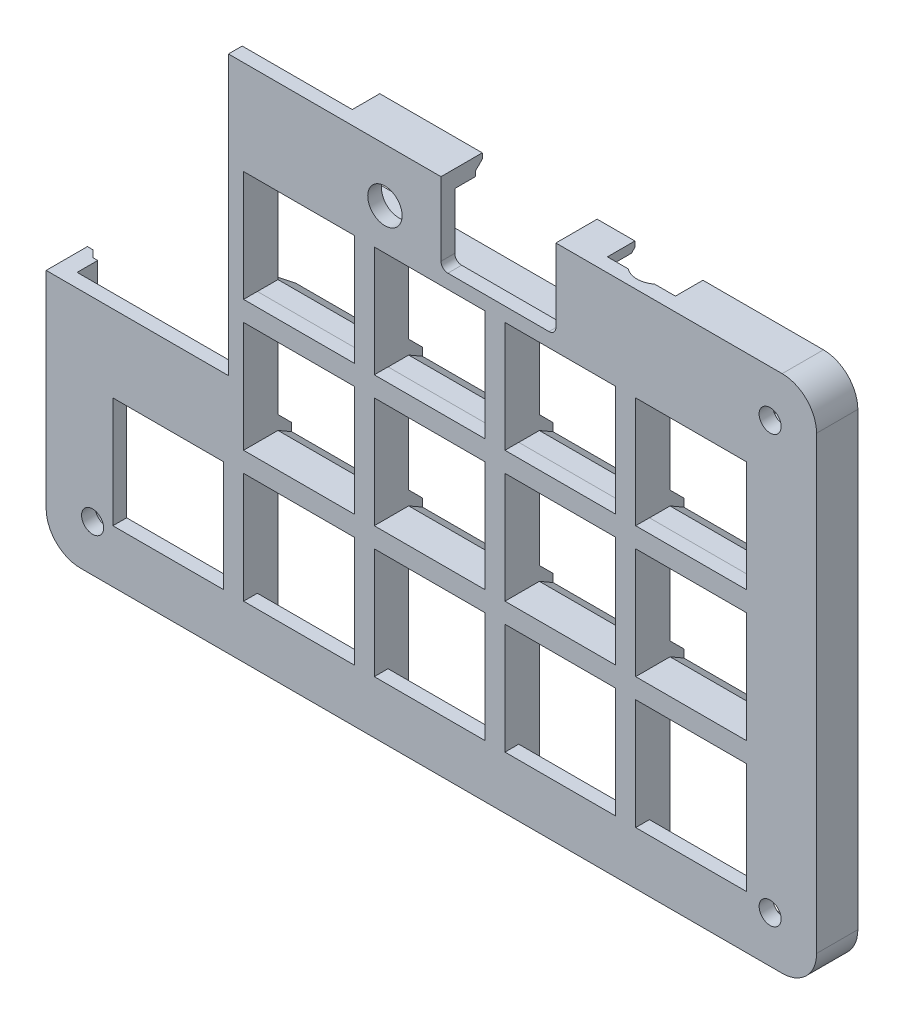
SolidWorks part; units mm, degrees
ref_plane "Front Plane" through (0, 0, 0) normal (0, 0, 1) x (1, 0, 0)
ref_plane "Top Plane" through (0, 0, 0) normal (0, 1, 0) x (1, 0, 0)
ref_plane "Right Plane" through (0, 0, 0) normal (1, 0, 0) x (0, 0, -1)
sketch "Model" plane through (0, 0, 0) normal (0, 0, 1) x (1, 0, 0)
  line L0 (0, 67.46) -> (0, 2.54)
  line L1 (2.54, 0) -> (103.96, 0)
  line L2 (106.5, 2.54) -> (106.5, 67.46)
  line L3 (103.96, 70) -> (2.54, 70)
  line L4 (82.3355, 61.0275) -> (75.5483, 71.0918) construction
  line L14 (88.4517, 60.2937) -> (88.4517, 71.0918)
  line L15 (88.4517, 71.0918) -> (85.0749, 71.0918)
  line L16 (75.5483, 60.2937) -> (75.5483, 71.0918)
  line L17 (75.5483, 60.2937) -> (88.4517, 60.2937)
  line L18 (88.4517, 71.0918) -> (81.6645, 61.0275) construction
  line L19 (78.3969, 71.0918) -> (75.5483, 71.0918)
  line L21 (85.0749, 71.0918) -> (85.0749, 71.9406)
  line L22 (85.0749, 71.9406) -> (78.3969, 71.9406)
  line L23 (78.3969, 71.0918) -> (78.3969, 71.9406)
  line L24 (0, 35) -> (106.5, 35)
  line L31 (53.25, 70) -> (53.25, 0)
  line L411 (28.1603, 66.5296) -> (28.0375, 66.4067)
  line L412 (28.0375, 66.4067) -> (28.0375, 66.161)
  line L413 (28.0375, 66.161) -> (28.1603, 66.0381)
  line L414 (28.1603, 66.0381) -> (28.6518, 66.0381)
  line L415 (28.6518, 66.0381) -> (28.7747, 66.161)
  line L416 (28.7747, 66.161) -> (28.7747, 66.4067)
  line L417 (28.7747, 66.4067) -> (28.6518, 66.5296)
  line L418 (28.6518, 66.5296) -> (28.4061, 66.5296)
  line L419 (28.4061, 66.5296) -> (28.4061, 66.2838)
  line L420 (28.7747, 66.7865) -> (28.0375, 66.7865)
  line L421 (28.0375, 66.7865) -> (28.7747, 67.278)
  line L422 (28.7747, 67.278) -> (28.0375, 67.278)
  line L423 (28.0375, 67.5349) -> (28.7747, 67.5349)
  line L424 (28.7747, 67.5349) -> (28.7747, 67.9035)
  line L425 (28.7747, 67.9035) -> (28.6518, 68.0264)
  line L426 (28.6518, 68.0264) -> (28.1603, 68.0264)
  line L427 (28.1603, 68.0264) -> (28.0375, 67.9035)
  line L428 (28.0375, 67.9035) -> (28.0375, 67.5349)
  line L429 (30.4759, 66.0381) -> (30.9674, 66.0381)
  line L430 (30.9674, 66.0381) -> (31.2131, 66.2838)
  line L431 (31.2131, 66.2838) -> (30.9674, 66.5296)
  line L432 (30.9674, 66.5296) -> (30.4759, 66.5296)
  line L433 (30.5987, 67.278) -> (30.4759, 67.1551)
  line L434 (30.4759, 67.1551) -> (30.4759, 66.9094)
  line L435 (30.4759, 66.9094) -> (30.5987, 66.7865)
  line L436 (30.5987, 66.7865) -> (31.0902, 66.7865)
  line L437 (31.0902, 66.7865) -> (31.2131, 66.9094)
  line L438 (31.2131, 66.9094) -> (31.2131, 67.1551)
  line L439 (31.2131, 67.1551) -> (31.0902, 67.278)
  line L440 (30.5987, 68.0264) -> (30.4759, 67.9035)
  line L441 (30.4759, 67.9035) -> (30.4759, 67.6578)
  line L442 (30.4759, 67.6578) -> (30.5987, 67.5349)
  line L443 (30.5987, 67.5349) -> (31.0902, 67.5349)
  line L444 (31.0902, 67.5349) -> (31.2131, 67.6578)
  line L445 (31.2131, 67.6578) -> (31.2131, 67.9035)
  line L446 (31.2131, 67.9035) -> (31.0902, 68.0264)
  line L447 (33.0371, 66.5296) -> (32.9143, 66.4067)
  line L448 (32.9143, 66.4067) -> (32.9143, 66.161)
  line L449 (32.9143, 66.161) -> (33.0371, 66.0381)
  line L450 (33.0371, 66.0381) -> (33.16, 66.0381)
  line L451 (33.16, 66.0381) -> (33.2829, 66.161)
  line L452 (33.2829, 66.161) -> (33.2829, 66.4067)
  line L453 (33.2829, 66.4067) -> (33.4058, 66.5296)
  line L454 (33.4058, 66.5296) -> (33.5286, 66.5296)
  line L455 (33.5286, 66.5296) -> (33.6515, 66.4067)
  line L456 (33.6515, 66.4067) -> (33.6515, 66.161)
  line L457 (33.6515, 66.161) -> (33.5286, 66.0381)
  line L458 (32.9143, 66.7865) -> (33.6515, 66.7865)
  line L459 (33.6515, 66.7865) -> (33.6515, 67.1551)
  line L460 (33.6515, 67.1551) -> (33.5286, 67.278)
  line L461 (33.5286, 67.278) -> (33.0371, 67.278)
  line L462 (33.0371, 67.278) -> (32.9143, 67.1551)
  line L463 (32.9143, 67.1551) -> (32.9143, 66.7865)
  line L464 (33.6515, 67.5349) -> (33.16, 67.5349)
  line L465 (33.16, 67.5349) -> (32.9143, 67.7807)
  line L466 (32.9143, 67.7807) -> (33.16, 68.0264)
  line L467 (33.16, 68.0264) -> (33.6515, 68.0264)
  line L468 (33.2829, 67.5349) -> (33.2829, 68.0264)
  line L469 (35.4755, 66.5296) -> (35.3527, 66.4067)
  line L470 (35.3527, 66.4067) -> (35.3527, 66.161)
  line L471 (35.3527, 66.161) -> (35.4755, 66.0381)
  line L472 (35.4755, 66.0381) -> (35.5984, 66.0381)
  line L473 (35.5984, 66.0381) -> (35.7213, 66.161)
  line L474 (35.7213, 66.161) -> (35.7213, 66.4067)
  line L475 (35.7213, 66.4067) -> (35.8442, 66.5296)
  line L476 (35.8442, 66.5296) -> (35.967, 66.5296)
  line L477 (35.967, 66.5296) -> (36.0899, 66.4067)
  line L478 (36.0899, 66.4067) -> (36.0899, 66.161)
  line L479 (36.0899, 66.161) -> (35.967, 66.0381)
  line L480 (35.4755, 67.278) -> (35.3527, 67.1551)
  line L481 (35.3527, 67.1551) -> (35.3527, 66.9094)
  line L482 (35.3527, 66.9094) -> (35.4755, 66.7865)
  line L483 (35.4755, 66.7865) -> (35.967, 66.7865)
  line L484 (35.967, 66.7865) -> (36.0899, 66.9094)
  line L485 (36.0899, 66.9094) -> (36.0899, 67.1551)
  line L486 (36.0899, 67.1551) -> (35.967, 67.278)
  line L487 (35.3527, 67.5349) -> (36.0899, 67.5349)
  line L488 (36.0899, 67.5349) -> (36.0899, 68.0264)
  line L525 (5.5, 66.5) -> (23.28, 66.5)
  line L526 (23.28, 66.5) -> (23.28, 33.48)
  line L527 (23.28, 33.48) -> (5.5, 33.48)
  line L528 (5.5, 33.48) -> (5.5, 66.5)
  line L1192 (71.35, 68.8985) -> (54.65, 68.8985)
  line L1193 (71.35, 61.1) -> (54.65, 61.1)
  line L1194 (71.35, 68.8985) -> (71.35, 61.1)
  line L1195 (54.65, 68.8985) -> (54.65, 61.1)
  line L1214 (26.38, 59.89) -> (41.62, 59.89)
  line L1215 (42.89, 58.62) -> (42.89, 43.38)
  line L1216 (41.62, 42.11) -> (26.38, 42.11)
  line L1217 (25.11, 43.38) -> (25.11, 58.62)
  line L1241 (45.38, 59.89) -> (60.62, 59.89)
  line L1242 (61.89, 58.62) -> (61.89, 43.38)
  line L1243 (60.62, 42.11) -> (45.38, 42.11)
  line L1244 (44.11, 43.38) -> (44.11, 58.62)
  line L1271 (64.38, 59.89) -> (79.62, 59.89)
  line L1272 (80.89, 58.62) -> (80.89, 43.38)
  line L1273 (79.62, 42.11) -> (64.38, 42.11)
  line L1274 (63.11, 43.38) -> (63.11, 58.62)
  line L1306 (83.38, 59.89) -> (98.62, 59.89)
  line L1307 (99.89, 58.62) -> (99.89, 43.38)
  line L1308 (98.62, 42.11) -> (83.38, 42.11)
  line L1309 (82.11, 43.38) -> (82.11, 58.62)
  line L1333 (26.38, 40.89) -> (41.62, 40.89)
  line L1334 (42.89, 39.62) -> (42.89, 24.38)
  line L1335 (41.62, 23.11) -> (26.38, 23.11)
  line L1336 (25.11, 24.38) -> (25.11, 39.62)
  line L1366 (45.38, 40.89) -> (60.62, 40.89)
  line L1367 (61.89, 39.62) -> (61.89, 24.38)
  line L1368 (60.62, 23.11) -> (45.38, 23.11)
  line L1369 (44.11, 24.38) -> (44.11, 39.62)
  line L1399 (64.38, 40.89) -> (79.62, 40.89)
  line L1400 (80.89, 39.62) -> (80.89, 24.38)
  line L1401 (79.62, 23.11) -> (64.38, 23.11)
  line L1402 (63.11, 24.38) -> (63.11, 39.62)
  line L1427 (83.38, 40.89) -> (98.62, 40.89)
  line L1428 (99.89, 39.62) -> (99.89, 24.38)
  line L1429 (98.62, 23.11) -> (83.38, 23.11)
  line L1430 (82.11, 24.38) -> (82.11, 39.62)
  line L1466 (26.38, 21.89) -> (41.62, 21.89)
  line L1467 (42.89, 20.62) -> (42.89, 5.38)
  line L1468 (41.62, 4.11) -> (26.38, 4.11)
  line L1469 (25.11, 5.38) -> (25.11, 20.62)
  line L1522 (45.38, 21.89) -> (60.62, 21.89)
  line L1523 (61.89, 20.62) -> (61.89, 5.38)
  line L1524 (60.62, 4.11) -> (45.38, 4.11)
  line L1525 (44.11, 5.38) -> (44.11, 20.62)
  line L1558 (64.38, 21.89) -> (79.62, 21.89)
  line L1559 (80.89, 20.62) -> (80.89, 5.38)
  line L1560 (79.62, 4.11) -> (64.38, 4.11)
  line L1561 (63.11, 5.38) -> (63.11, 20.62)
  line L1588 (83.38, 21.89) -> (98.62, 21.89)
  line L1589 (99.89, 20.62) -> (99.89, 5.38)
  line L1590 (98.62, 4.11) -> (83.38, 4.11)
  line L1591 (82.11, 5.38) -> (82.11, 20.62)
  line L1621 (7.38, 21.89) -> (22.62, 21.89)
  line L1622 (23.89, 20.62) -> (23.89, 5.38)
  line L1623 (22.62, 4.11) -> (7.38, 4.11)
  line L1624 (6.11, 5.38) -> (6.11, 20.62)
  arc A0 (0, 2.54) -> (2.54, 0) centre (2.54, 2.54) ccw
  arc A1 (103.96, 0) -> (106.5, 2.54) centre (103.96, 2.54) ccw
  arc A2 (106.5, 67.46) -> (103.96, 70) centre (103.96, 67.46) ccw
  arc A3 (2.54, 70) -> (0, 67.46) centre (2.54, 67.46) ccw
  circle A4 centre (77, 66.525) radius 0.6
  circle A5 centre (77, 69.025) radius 0.6
  circle A6 centre (87, 69.025) radius 0.6
  circle A7 centre (87, 66.525) radius 0.6
  circle A8 centre (82, 61.525) radius 0.6
  circle A9 centre (34, 51) radius 2.0002
  circle A10 centre (53, 51) radius 2.0002
  circle A11 centre (72, 51) radius 2.0002
  circle A12 centre (91, 51) radius 2.0002
  circle A13 centre (34, 32) radius 2.0002
  circle A14 centre (53, 32) radius 2.0002
  circle A15 centre (72, 32) radius 2.0002
  circle A16 centre (91, 32) radius 2.0002
  circle A17 centre (34, 13) radius 2.0002
  circle A18 centre (53, 13) radius 2.0002
  circle A19 centre (72, 13) radius 2.0002
  circle A20 centre (91, 13) radius 2.0002
  circle A21 centre (15, 13) radius 2.0002
  circle A74 centre (14.5, 60) radius 1.5
  circle A75 centre (102.5, 4) radius 1.5
  circle A76 centre (4, 4) radius 1.5
  circle A77 centre (102.5, 66) radius 1.5
  arc A892 (28.024, 66.4202) -> (28.0509, 66.3932) centre (28.0374, 66.4067) ccw
  arc A893 (28.1738, 66.5161) -> (28.1469, 66.5431) centre (28.1604, 66.5296) ccw
  arc A894 (28.0184, 66.161) -> (28.0565, 66.161) centre (28.0374, 66.161) ccw
  arc A895 (28.0565, 66.4067) -> (28.0184, 66.4067) centre (28.0374, 66.4067) ccw
  arc A896 (28.1469, 66.0246) -> (28.1738, 66.0516) centre (28.1604, 66.0381) ccw
  arc A897 (28.0509, 66.1744) -> (28.024, 66.1475) centre (28.0374, 66.1609) ccw
  arc A898 (28.6518, 66.0191) -> (28.6518, 66.0571) centre (28.6518, 66.0381) ccw
  arc A899 (28.1603, 66.0571) -> (28.1603, 66.0191) centre (28.1603, 66.0381) ccw
  arc A900 (28.7882, 66.1475) -> (28.7612, 66.1744) centre (28.7747, 66.1609) ccw
  arc A901 (28.6384, 66.0516) -> (28.6653, 66.0246) centre (28.6518, 66.0381) ccw
  arc A902 (28.7938, 66.4067) -> (28.7557, 66.4067) centre (28.7748, 66.4067) ccw
  arc A903 (28.7557, 66.161) -> (28.7938, 66.161) centre (28.7748, 66.161) ccw
  arc A904 (28.6653, 66.5431) -> (28.6384, 66.5161) centre (28.6518, 66.5296) ccw
  arc A905 (28.7612, 66.3932) -> (28.7882, 66.4202) centre (28.7747, 66.4067) ccw
  arc A906 (28.4061, 66.5486) -> (28.4061, 66.5105) centre (28.4061, 66.5295) ccw
  arc A907 (28.6518, 66.5105) -> (28.6518, 66.5486) centre (28.6518, 66.5295) ccw
  arc A908 (28.387, 66.2838) -> (28.4251, 66.2838) centre (28.4061, 66.2838) ccw
  arc A909 (28.4251, 66.5296) -> (28.387, 66.5296) centre (28.4061, 66.5296) ccw
  arc A910 (28.0375, 66.8056) -> (28.0375, 66.7675) centre (28.0375, 66.7866) ccw
  arc A911 (28.7747, 66.7675) -> (28.7747, 66.8056) centre (28.7747, 66.7866) ccw
  arc A912 (28.7853, 67.2621) -> (28.7641, 67.2939) centre (28.7747, 67.278) ccw
  arc A913 (28.0269, 66.8024) -> (28.048, 66.7707) centre (28.0374, 66.7866) ccw
  arc A914 (28.0375, 67.297) -> (28.0375, 67.259) centre (28.0375, 67.278) ccw
  arc A915 (28.7747, 67.259) -> (28.7747, 67.297) centre (28.7747, 67.278) ccw
  arc A916 (28.7747, 67.5159) -> (28.7747, 67.554) centre (28.7747, 67.535) ccw
  arc A917 (28.0375, 67.554) -> (28.0375, 67.5159) centre (28.0375, 67.535) ccw
  arc A918 (28.7938, 67.9035) -> (28.7557, 67.9035) centre (28.7748, 67.9035) ccw
  arc A919 (28.7557, 67.5349) -> (28.7938, 67.5349) centre (28.7748, 67.5349) ccw
  arc A920 (28.6653, 68.0399) -> (28.6384, 68.0129) centre (28.6518, 68.0264) ccw
  arc A921 (28.7612, 67.8901) -> (28.7882, 67.917) centre (28.7747, 67.9036) ccw
  arc A922 (28.1603, 68.0455) -> (28.1603, 68.0074) centre (28.1603, 68.0265) ccw
  arc A923 (28.6518, 68.0074) -> (28.6518, 68.0455) centre (28.6518, 68.0265) ccw
  arc A924 (28.024, 67.917) -> (28.0509, 67.8901) centre (28.0374, 67.9036) ccw
  arc A925 (28.1738, 68.0129) -> (28.1469, 68.0399) centre (28.1604, 68.0264) ccw
  arc A926 (28.0184, 67.5349) -> (28.0565, 67.5349) centre (28.0374, 67.5349) ccw
  arc A927 (28.0565, 67.9035) -> (28.0184, 67.9035) centre (28.0374, 67.9035) ccw
  arc A928 (30.9674, 66.0191) -> (30.9674, 66.0571) centre (30.9674, 66.0381) ccw
  arc A929 (30.4759, 66.0571) -> (30.4759, 66.0191) centre (30.4759, 66.0381) ccw
  arc A930 (31.2266, 66.2704) -> (31.1996, 66.2973) centre (31.2131, 66.2839) ccw
  arc A931 (30.9539, 66.0516) -> (30.9808, 66.0246) centre (30.9673, 66.0381) ccw
  arc A932 (30.9808, 66.5431) -> (30.9539, 66.5161) centre (30.9673, 66.5296) ccw
  arc A933 (31.1996, 66.2704) -> (31.2266, 66.2973) centre (31.2131, 66.2839) ccw
  arc A934 (30.4759, 66.5486) -> (30.4759, 66.5105) centre (30.4759, 66.5295) ccw
  arc A935 (30.9674, 66.5105) -> (30.9674, 66.5486) centre (30.9674, 66.5295) ccw
  arc A936 (30.4624, 67.1686) -> (30.4893, 67.1417) centre (30.4758, 67.1551) ccw
  arc A937 (30.6122, 67.2645) -> (30.5853, 67.2915) centre (30.5988, 67.278) ccw
  arc A938 (30.4568, 66.9094) -> (30.4949, 66.9094) centre (30.4759, 66.9094) ccw
  arc A939 (30.4949, 67.1551) -> (30.4568, 67.1551) centre (30.4759, 67.1551) ccw
  arc A940 (30.5853, 66.773) -> (30.6122, 66.8) centre (30.5988, 66.7865) ccw
  arc A941 (30.4893, 66.9229) -> (30.4624, 66.8959) centre (30.4759, 66.9094) ccw
  arc A942 (31.0902, 66.7675) -> (31.0902, 66.8056) centre (31.0902, 66.7866) ccw
  arc A943 (30.5987, 66.8056) -> (30.5987, 66.7675) centre (30.5987, 66.7866) ccw
  arc A944 (31.2266, 66.8959) -> (31.1996, 66.9229) centre (31.2131, 66.9094) ccw
  arc A945 (31.0768, 66.8) -> (31.1037, 66.773) centre (31.0903, 66.7865) ccw
  arc A946 (31.2322, 67.1551) -> (31.1941, 67.1551) centre (31.2131, 67.1551) ccw
  arc A947 (31.1941, 66.9094) -> (31.2322, 66.9094) centre (31.2131, 66.9094) ccw
  arc A948 (31.1037, 67.2915) -> (31.0768, 67.2645) centre (31.0903, 67.278) ccw
  arc A949 (31.1996, 67.1417) -> (31.2266, 67.1686) centre (31.2131, 67.1551) ccw
  arc A950 (30.4624, 67.917) -> (30.4893, 67.8901) centre (30.4758, 67.9036) ccw
  arc A951 (30.6122, 68.0129) -> (30.5853, 68.0399) centre (30.5988, 68.0264) ccw
  arc A952 (30.4568, 67.6578) -> (30.4949, 67.6578) centre (30.4759, 67.6578) ccw
  arc A953 (30.4949, 67.9035) -> (30.4568, 67.9035) centre (30.4759, 67.9035) ccw
  arc A954 (30.5853, 67.5215) -> (30.6122, 67.5484) centre (30.5988, 67.535) ccw
  arc A955 (30.4893, 67.6713) -> (30.4624, 67.6443) centre (30.4759, 67.6578) ccw
  arc A956 (31.0902, 67.5159) -> (31.0902, 67.554) centre (31.0902, 67.535) ccw
  arc A957 (30.5987, 67.554) -> (30.5987, 67.5159) centre (30.5987, 67.535) ccw
  arc A958 (31.2266, 67.6443) -> (31.1996, 67.6713) centre (31.2131, 67.6578) ccw
  arc A959 (31.0768, 67.5484) -> (31.1037, 67.5215) centre (31.0903, 67.535) ccw
  arc A960 (31.2322, 67.9035) -> (31.1941, 67.9035) centre (31.2131, 67.9035) ccw
  arc A961 (31.1941, 67.6578) -> (31.2322, 67.6578) centre (31.2131, 67.6578) ccw
  arc A962 (31.1037, 68.0399) -> (31.0768, 68.0129) centre (31.0903, 68.0264) ccw
  arc A963 (31.1996, 67.8901) -> (31.2266, 67.917) centre (31.2131, 67.9036) ccw
  arc A964 (32.9008, 66.4202) -> (32.9277, 66.3932) centre (32.9142, 66.4067) ccw
  arc A965 (33.0506, 66.5161) -> (33.0237, 66.5431) centre (33.0372, 66.5296) ccw
  arc A966 (32.8952, 66.161) -> (32.9333, 66.161) centre (32.9143, 66.161) ccw
  arc A967 (32.9333, 66.4067) -> (32.8952, 66.4067) centre (32.9142, 66.4067) ccw
  arc A968 (33.0237, 66.0246) -> (33.0506, 66.0516) centre (33.0372, 66.0381) ccw
  arc A969 (32.9277, 66.1744) -> (32.9008, 66.1475) centre (32.9142, 66.1609) ccw
  arc A970 (33.16, 66.0191) -> (33.16, 66.0571) centre (33.16, 66.0381) ccw
  arc A971 (33.0371, 66.0571) -> (33.0371, 66.0191) centre (33.0371, 66.0381) ccw
  arc A972 (33.2964, 66.1475) -> (33.2694, 66.1744) centre (33.2829, 66.1609) ccw
  arc A973 (33.1465, 66.0516) -> (33.1735, 66.0246) centre (33.16, 66.0381) ccw
  arc A974 (33.3019, 66.4067) -> (33.2638, 66.4067) centre (33.2829, 66.4067) ccw
  arc A975 (33.2638, 66.161) -> (33.3019, 66.161) centre (33.2829, 66.161) ccw
  arc A976 (33.4192, 66.5161) -> (33.3923, 66.5431) centre (33.4057, 66.5296) ccw
  arc A977 (33.2694, 66.4202) -> (33.2964, 66.3932) centre (33.2829, 66.4067) ccw
  arc A978 (33.5286, 66.5105) -> (33.5286, 66.5486) centre (33.5286, 66.5295) ccw
  arc A979 (33.4058, 66.5486) -> (33.4058, 66.5105) centre (33.4058, 66.5295) ccw
  arc A980 (33.638, 66.3932) -> (33.665, 66.4202) centre (33.6515, 66.4067) ccw
  arc A981 (33.5421, 66.5431) -> (33.5152, 66.5161) centre (33.5286, 66.5296) ccw
  arc A982 (33.6324, 66.161) -> (33.6705, 66.161) centre (33.6514, 66.161) ccw
  arc A983 (33.6705, 66.4067) -> (33.6324, 66.4067) centre (33.6514, 66.4067) ccw
  arc A984 (33.5152, 66.0516) -> (33.5421, 66.0246) centre (33.5286, 66.0381) ccw
  arc A985 (33.665, 66.1475) -> (33.638, 66.1744) centre (33.6515, 66.1609) ccw
  arc A986 (33.6515, 66.7675) -> (33.6515, 66.8056) centre (33.6515, 66.7866) ccw
  arc A987 (32.9143, 66.8056) -> (32.9143, 66.7675) centre (32.9143, 66.7866) ccw
  arc A988 (33.6705, 67.1551) -> (33.6324, 67.1551) centre (33.6514, 67.1551) ccw
  arc A989 (33.6324, 66.7865) -> (33.6705, 66.7865) centre (33.6514, 66.7865) ccw
  arc A990 (33.5421, 67.2915) -> (33.5152, 67.2645) centre (33.5286, 67.278) ccw
  arc A991 (33.638, 67.1417) -> (33.665, 67.1686) centre (33.6515, 67.1551) ccw
  arc A992 (33.0371, 67.297) -> (33.0371, 67.259) centre (33.0371, 67.278) ccw
  arc A993 (33.5286, 67.259) -> (33.5286, 67.297) centre (33.5286, 67.278) ccw
  arc A994 (32.9008, 67.1686) -> (32.9277, 67.1417) centre (32.9142, 67.1551) ccw
  arc A995 (33.0506, 67.2645) -> (33.0237, 67.2915) centre (33.0372, 67.278) ccw
  arc A996 (32.8952, 66.7865) -> (32.9333, 66.7865) centre (32.9143, 66.7865) ccw
  arc A997 (32.9333, 67.1551) -> (32.8952, 67.1551) centre (32.9143, 67.1551) ccw
  arc A998 (33.16, 67.554) -> (33.16, 67.5159) centre (33.16, 67.535) ccw
  arc A999 (33.6515, 67.5159) -> (33.6515, 67.554) centre (33.6515, 67.535) ccw
  arc A1000 (32.9277, 67.7941) -> (32.9008, 67.7672) centre (32.9142, 67.7806) ccw
  arc A1001 (33.1465, 67.5215) -> (33.1735, 67.5484) centre (33.16, 67.535) ccw
  arc A1002 (33.1735, 68.0129) -> (33.1465, 68.0399) centre (33.16, 68.0264) ccw
  arc A1003 (32.9008, 67.7941) -> (32.9277, 67.7672) centre (32.9142, 67.7806) ccw
  arc A1004 (33.6515, 68.0074) -> (33.6515, 68.0455) centre (33.6515, 68.0265) ccw
  arc A1005 (33.16, 68.0455) -> (33.16, 68.0074) centre (33.16, 68.0265) ccw
  arc A1006 (33.3019, 68.0264) -> (33.2638, 68.0264) centre (33.2829, 68.0264) ccw
  arc A1007 (33.2638, 67.5349) -> (33.3019, 67.5349) centre (33.2829, 67.5349) ccw
  arc A1008 (35.3392, 66.4202) -> (35.3661, 66.3932) centre (35.3526, 66.4067) ccw
  arc A1009 (35.489, 66.5161) -> (35.4621, 66.5431) centre (35.4755, 66.5296) ccw
  arc A1010 (35.3336, 66.161) -> (35.3717, 66.161) centre (35.3526, 66.161) ccw
  arc A1011 (35.3717, 66.4067) -> (35.3336, 66.4067) centre (35.3526, 66.4067) ccw
  arc A1012 (35.4621, 66.0246) -> (35.489, 66.0516) centre (35.4755, 66.0381) ccw
  arc A1013 (35.3661, 66.1744) -> (35.3392, 66.1475) centre (35.3526, 66.1609) ccw
  arc A1014 (35.5984, 66.0191) -> (35.5984, 66.0571) centre (35.5984, 66.0381) ccw
  arc A1015 (35.4755, 66.0571) -> (35.4755, 66.0191) centre (35.4755, 66.0381) ccw
  arc A1016 (35.7348, 66.1475) -> (35.7078, 66.1744) centre (35.7213, 66.1609) ccw
  arc A1017 (35.5849, 66.0516) -> (35.6119, 66.0246) centre (35.5984, 66.0381) ccw
  arc A1018 (35.7403, 66.4067) -> (35.7022, 66.4067) centre (35.7212, 66.4067) ccw
  arc A1019 (35.7022, 66.161) -> (35.7403, 66.161) centre (35.7212, 66.161) ccw
  arc A1020 (35.8576, 66.5161) -> (35.8307, 66.5431) centre (35.8441, 66.5296) ccw
  arc A1021 (35.7078, 66.4202) -> (35.7348, 66.3932) centre (35.7213, 66.4067) ccw
  arc A1022 (35.967, 66.5105) -> (35.967, 66.5486) centre (35.967, 66.5295) ccw
  arc A1023 (35.8442, 66.5486) -> (35.8442, 66.5105) centre (35.8442, 66.5295) ccw
  arc A1024 (36.0764, 66.3932) -> (36.1034, 66.4202) centre (36.0899, 66.4067) ccw
  arc A1025 (35.9805, 66.5431) -> (35.9536, 66.5161) centre (35.9671, 66.5296) ccw
  arc A1026 (36.0709, 66.161) -> (36.109, 66.161) centre (36.09, 66.161) ccw
  arc A1027 (36.109, 66.4067) -> (36.0709, 66.4067) centre (36.09, 66.4067) ccw
  arc A1028 (35.9536, 66.0516) -> (35.9805, 66.0246) centre (35.9671, 66.0381) ccw
  arc A1029 (36.1034, 66.1475) -> (36.0764, 66.1744) centre (36.0899, 66.1609) ccw
  arc A1030 (35.3392, 67.1686) -> (35.3661, 67.1417) centre (35.3526, 67.1551) ccw
  arc A1031 (35.489, 67.2645) -> (35.4621, 67.2915) centre (35.4755, 67.278) ccw
  arc A1032 (35.3336, 66.9094) -> (35.3717, 66.9094) centre (35.3526, 66.9094) ccw
  arc A1033 (35.3717, 67.1551) -> (35.3336, 67.1551) centre (35.3526, 67.1551) ccw
  arc A1034 (35.4621, 66.773) -> (35.489, 66.8) centre (35.4755, 66.7865) ccw
  arc A1035 (35.3661, 66.9229) -> (35.3392, 66.8959) centre (35.3526, 66.9094) ccw
  arc A1036 (35.967, 66.7675) -> (35.967, 66.8056) centre (35.967, 66.7866) ccw
  arc A1037 (35.4755, 66.8056) -> (35.4755, 66.7675) centre (35.4755, 66.7866) ccw
  arc A1038 (36.1034, 66.8959) -> (36.0764, 66.9229) centre (36.0899, 66.9094) ccw
  arc A1039 (35.9536, 66.8) -> (35.9805, 66.773) centre (35.9671, 66.7865) ccw
  arc A1040 (36.109, 67.1551) -> (36.0709, 67.1551) centre (36.09, 67.1551) ccw
  arc A1041 (36.0709, 66.9094) -> (36.109, 66.9094) centre (36.09, 66.9094) ccw
  arc A1042 (35.9805, 67.2915) -> (35.9536, 67.2645) centre (35.9671, 67.278) ccw
  arc A1043 (36.0764, 67.1417) -> (36.1034, 67.1686) centre (36.0899, 67.1551) ccw
  arc A1044 (36.0899, 67.5159) -> (36.0899, 67.554) centre (36.0899, 67.535) ccw
  arc A1045 (35.3527, 67.554) -> (35.3527, 67.5159) centre (35.3527, 67.535) ccw
  arc A1046 (36.109, 68.0264) -> (36.0709, 68.0264) centre (36.09, 68.0264) ccw
  arc A1047 (36.0709, 67.5349) -> (36.109, 67.5349) centre (36.09, 67.5349) ccw
  arc A1120 (23.28, 66.4682) -> (23.28, 66.5318) centre (23.28, 66.5) ccw
  arc A1121 (5.5, 66.5318) -> (5.5, 66.4682) centre (5.5, 66.5) ccw
  arc A1122 (23.2483, 33.48) -> (23.3117, 33.48) centre (23.28, 33.48) ccw
  arc A1123 (23.3117, 66.5) -> (23.2483, 66.5) centre (23.28, 66.5) ccw
  arc A1124 (5.5, 33.5118) -> (5.5, 33.4483) centre (5.5, 33.4801) ccw
  arc A1125 (23.28, 33.4483) -> (23.28, 33.5118) centre (23.28, 33.4801) ccw
  arc A1126 (5.5317, 66.5) -> (5.4683, 66.5) centre (5.5, 66.5) ccw
  arc A1127 (5.4683, 33.48) -> (5.5317, 33.48) centre (5.5, 33.48) ccw
  arc A2454 (54.65, 68.9493) -> (54.65, 68.8477) centre (54.65, 68.8985) ccw
  arc A2455 (71.35, 68.8477) -> (71.35, 68.9493) centre (71.35, 68.8985) ccw
  arc A2456 (54.65, 61.1508) -> (54.65, 61.0492) centre (54.65, 61.1) ccw
  arc A2457 (71.35, 61.0492) -> (71.35, 61.1508) centre (71.35, 61.1) ccw
  arc A2458 (71.2992, 61.1) -> (71.4008, 61.1) centre (71.35, 61.1) ccw
  arc A2459 (71.4008, 68.8985) -> (71.2992, 68.8985) centre (71.35, 68.8985) ccw
  arc A2460 (54.5992, 61.1) -> (54.7008, 61.1) centre (54.65, 61.1) ccw
  arc A2461 (54.7008, 68.8985) -> (54.5992, 68.8985) centre (54.65, 68.8985) ccw
  arc A2500 (42.89, 58.62) -> (41.62, 59.89) centre (41.62, 58.62) ccw
  arc A2505 (41.62, 42.11) -> (42.89, 43.38) centre (41.62, 43.38) ccw
  arc A2510 (25.11, 43.38) -> (26.38, 42.11) centre (26.38, 43.38) ccw
  arc A2515 (26.38, 59.89) -> (25.11, 58.62) centre (26.38, 58.62) ccw
  arc A2566 (61.89, 58.62) -> (60.62, 59.89) centre (60.62, 58.62) ccw
  arc A2571 (60.62, 42.11) -> (61.89, 43.38) centre (60.62, 43.38) ccw
  arc A2576 (44.11, 43.38) -> (45.38, 42.11) centre (45.38, 43.38) ccw
  arc A2581 (45.38, 59.89) -> (44.11, 58.62) centre (45.38, 58.62) ccw
  arc A2638 (80.89, 58.62) -> (79.62, 59.89) centre (79.62, 58.62) ccw
  arc A2643 (79.62, 42.11) -> (80.89, 43.38) centre (79.62, 43.38) ccw
  arc A2648 (63.11, 43.38) -> (64.38, 42.11) centre (64.38, 43.38) ccw
  arc A2653 (64.38, 59.89) -> (63.11, 58.62) centre (64.38, 58.62) ccw
  arc A2720 (99.89, 58.62) -> (98.62, 59.89) centre (98.62, 58.62) ccw
  arc A2725 (98.62, 42.11) -> (99.89, 43.38) centre (98.62, 43.38) ccw
  arc A2730 (82.11, 43.38) -> (83.38, 42.11) centre (83.38, 43.38) ccw
  arc A2735 (83.38, 59.89) -> (82.11, 58.62) centre (83.38, 58.62) ccw
  arc A2786 (42.89, 39.62) -> (41.62, 40.89) centre (41.62, 39.62) ccw
  arc A2791 (41.62, 23.11) -> (42.89, 24.38) centre (41.62, 24.38) ccw
  arc A2796 (25.11, 24.38) -> (26.38, 23.11) centre (26.38, 24.38) ccw
  arc A2801 (26.38, 40.89) -> (25.11, 39.62) centre (26.38, 39.62) ccw
  arc A2864 (61.89, 39.62) -> (60.62, 40.89) centre (60.62, 39.62) ccw
  arc A2869 (60.62, 23.11) -> (61.89, 24.38) centre (60.62, 24.38) ccw
  arc A2874 (44.11, 24.38) -> (45.38, 23.11) centre (45.38, 24.38) ccw
  arc A2879 (45.38, 40.89) -> (44.11, 39.62) centre (45.38, 39.62) ccw
  arc A2942 (80.89, 39.62) -> (79.62, 40.89) centre (79.62, 39.62) ccw
  arc A2947 (79.62, 23.11) -> (80.89, 24.38) centre (79.62, 24.38) ccw
  arc A2952 (63.11, 24.38) -> (64.38, 23.11) centre (64.38, 24.38) ccw
  arc A2957 (64.38, 40.89) -> (63.11, 39.62) centre (64.38, 39.62) ccw
  arc A3010 (99.89, 39.62) -> (98.62, 40.89) centre (98.62, 39.62) ccw
  arc A3015 (98.62, 23.11) -> (99.89, 24.38) centre (98.62, 24.38) ccw
  arc A3020 (82.11, 24.38) -> (83.38, 23.11) centre (83.38, 24.38) ccw
  arc A3025 (83.38, 40.89) -> (82.11, 39.62) centre (83.38, 39.62) ccw
  arc A3100 (42.89, 20.62) -> (41.62, 21.89) centre (41.62, 20.62) ccw
  arc A3105 (41.62, 4.11) -> (42.89, 5.38) centre (41.62, 5.38) ccw
  arc A3110 (25.11, 5.38) -> (26.38, 4.11) centre (26.38, 5.38) ccw
  arc A3115 (26.38, 21.89) -> (25.11, 20.62) centre (26.38, 20.62) ccw
  arc A3224 (61.89, 20.62) -> (60.62, 21.89) centre (60.62, 20.62) ccw
  arc A3229 (60.62, 4.11) -> (61.89, 5.38) centre (60.62, 5.38) ccw
  arc A3234 (44.11, 5.38) -> (45.38, 4.11) centre (45.38, 5.38) ccw
  arc A3239 (45.38, 21.89) -> (44.11, 20.62) centre (45.38, 20.62) ccw
  arc A3308 (80.89, 20.62) -> (79.62, 21.89) centre (79.62, 20.62) ccw
  arc A3313 (79.62, 4.11) -> (80.89, 5.38) centre (79.62, 5.38) ccw
  arc A3318 (63.11, 5.38) -> (64.38, 4.11) centre (64.38, 5.38) ccw
  arc A3323 (64.38, 21.89) -> (63.11, 20.62) centre (64.38, 20.62) ccw
  arc A3380 (99.89, 20.62) -> (98.62, 21.89) centre (98.62, 20.62) ccw
  arc A3385 (98.62, 4.11) -> (99.89, 5.38) centre (98.62, 5.38) ccw
  arc A3390 (82.11, 5.38) -> (83.38, 4.11) centre (83.38, 5.38) ccw
  arc A3395 (83.38, 21.89) -> (82.11, 20.62) centre (83.38, 20.62) ccw
  arc A3458 (23.89, 20.62) -> (22.62, 21.89) centre (22.62, 20.62) ccw
  arc A3463 (22.62, 4.11) -> (23.89, 5.38) centre (22.62, 5.38) ccw
  arc A3468 (6.11, 5.38) -> (7.38, 4.11) centre (7.38, 5.38) ccw
  arc A3473 (7.38, 21.89) -> (6.11, 20.62) centre (7.38, 20.62) ccw
  circle A3860 centre (14.5, 60) radius 1.6
  circle A3861 centre (102.5, 4) radius 1.6
  circle A3862 centre (4, 4) radius 1.6
  circle A3863 centre (102.5, 66) radius 1.6
  point P52 (81.7359, 70)
  dimension "D1" = 106.5
  dimension "D2" = 70
sketch "Sketch2" plane through (0, 0, 0) normal (0, 0, 1) x (1, 0, 0)
  line L0 (0, 35) -> (106.5, 35) construction
  line L1 (104.25, -0.25) -> (2.25, -0.25)
  line L2 (106.75, 2.25) -> (106.75, 67.75)
  line L3 (104.25, 70.25) -> (2.25, 70.25)
  line L4 (-0.25, 2.25) -> (-0.25, 67.75)
  line L5 (106.75, -0.25) -> (-0.25, 70.25) construction
  line L6 (106.75, 70.25) -> (-0.25, -0.25) construction
  line L7 (104.25, 72.75) -> (2.25, 72.75)
  line L8 (-2.75, 2.25) -> (-2.75, 67.75)
  line L9 (104.25, -2.75) -> (2.25, -2.75)
  line L10 (109.25, 2.25) -> (109.25, 67.75)
  arc A0 (106.75, 67.75) -> (104.25, 70.25) centre (104.25, 67.75) ccw
  arc A1 (104.25, -0.25) -> (106.75, 2.25) centre (104.25, 2.25) ccw
  arc A2 (2.25, -0.25) -> (-0.25, 2.25) centre (2.25, 2.25) cw
  arc A3 (2.25, 70.25) -> (-0.25, 67.75) centre (2.25, 67.75) ccw
  arc A4 (2.25, 72.75) -> (-2.75, 67.75) centre (2.25, 67.75) ccw
  arc A5 (2.25, -2.75) -> (-2.75, 2.25) centre (2.25, 2.25) cw
  arc A6 (104.25, -2.75) -> (109.25, 2.25) centre (104.25, 2.25) ccw
  arc A7 (109.25, 67.75) -> (104.25, 72.75) centre (104.25, 67.75) ccw
  point P0 (53.25, 35)
  dimension "D3" = 2.5
  dimension "D1" = 70.5
  dimension "D2" = 107
  dimension "D4" = 2.5
extrude "Boss-Extrude1" add sketch "Sketch2" against normal blind 3
ref_point "Point1"
sketch "Sketch3" plane through (0, 0, 0) normal (0, 0, 1) x (1, 0, 0)
  line L5 (107.5, -1) -> (53.25, 35) construction
  line L6 (107.5, 71) -> (-1, -1) construction
  line L18 (2.25, 72.75) -> (104.25, 72.75)
  line L21 (109.25, 67.75) -> (109.25, 2.25)
  line L22 (104.25, -2.75) -> (2.25, -2.75)
  line L23 (-2.75, 2.25) -> (-2.75, 67.75)
  arc A9 (2.25, 72.75) -> (-2.75, 67.75) centre (2.25, 67.75) ccw
  arc A10 (2.25, -2.75) -> (-2.75, 2.25) centre (2.25, 2.25) cw
  arc A11 (109.25, 2.25) -> (104.25, -2.75) centre (104.25, 2.25) cw
  arc A12 (104.25, 72.75) -> (109.25, 67.75) centre (104.25, 67.75) cw
  point P0 (53.25, 35)
  dimension "D1" = 5
extrude "Boss-Extrude2" add sketch "Sketch3" along normal blind 2
sketch "Sketch4" plane through (0, 0, 2) normal (0, 0, 1) x (1, 0, 0)
  line L1 (42.05, 42.95) -> (25.95, 42.95)
  line L2 (42.05, 42.95) -> (42.05, 59.05)
  line L3 (42.05, 59.05) -> (25.95, 59.05)
  line L4 (25.95, 42.95) -> (25.95, 59.05)
  line L5 (42.05, 42.95) -> (25.95, 59.05) construction
  line L6 (42.05, 59.05) -> (25.95, 42.95) construction
  line L7 (61.05, 42.95) -> (44.95, 42.95)
  line L8 (61.05, 42.95) -> (61.05, 59.05)
  line L9 (61.05, 59.05) -> (44.95, 59.05)
  line L10 (44.95, 42.95) -> (44.95, 59.05)
  line L11 (61.05, 42.95) -> (44.95, 59.05) construction
  line L12 (61.05, 59.05) -> (44.95, 42.95) construction
  line L13 (80.05, 42.95) -> (63.95, 42.95)
  line L14 (80.05, 42.95) -> (80.05, 59.05)
  line L15 (80.05, 59.05) -> (63.95, 59.05)
  line L16 (63.95, 42.95) -> (63.95, 59.05)
  line L17 (80.05, 42.95) -> (63.95, 59.05) construction
  line L18 (80.05, 59.05) -> (63.95, 42.95) construction
  line L19 (99.05, 42.95) -> (82.95, 42.95)
  line L20 (99.05, 42.95) -> (99.05, 59.05)
  line L21 (99.05, 59.05) -> (82.95, 59.05)
  line L22 (82.95, 42.95) -> (82.95, 59.05)
  line L23 (99.05, 42.95) -> (82.95, 59.05) construction
  line L24 (99.05, 59.05) -> (82.95, 42.95) construction
  line L25 (42.05, 23.95) -> (25.95, 23.95)
  line L26 (42.05, 23.95) -> (42.05, 40.05)
  line L27 (42.05, 40.05) -> (25.95, 40.05)
  line L28 (25.95, 23.95) -> (25.95, 40.05)
  line L29 (42.05, 23.95) -> (25.95, 40.05) construction
  line L30 (42.05, 40.05) -> (25.95, 23.95) construction
  line L31 (61.05, 23.95) -> (44.95, 23.95)
  line L32 (61.05, 23.95) -> (61.05, 40.05)
  line L33 (61.05, 40.05) -> (44.95, 40.05)
  line L34 (44.95, 23.95) -> (44.95, 40.05)
  line L35 (61.05, 23.95) -> (44.95, 40.05) construction
  line L36 (61.05, 40.05) -> (44.95, 23.95) construction
  line L37 (80.05, 23.95) -> (63.95, 23.95)
  line L38 (80.05, 23.95) -> (80.05, 40.05)
  line L39 (80.05, 40.05) -> (63.95, 40.05)
  line L40 (63.95, 23.95) -> (63.95, 40.05)
  line L41 (80.05, 23.95) -> (63.95, 40.05) construction
  line L42 (80.05, 40.05) -> (63.95, 23.95) construction
  line L43 (99.05, 23.95) -> (82.95, 23.95)
  line L44 (99.05, 23.95) -> (99.05, 40.05)
  line L45 (99.05, 40.05) -> (82.95, 40.05)
  line L46 (82.95, 23.95) -> (82.95, 40.05)
  line L47 (99.05, 23.95) -> (82.95, 40.05) construction
  line L48 (99.05, 40.05) -> (82.95, 23.95) construction
  line L49 (99.05, 4.95) -> (82.95, 4.95)
  line L50 (99.05, 4.95) -> (99.05, 21.05)
  line L51 (99.05, 21.05) -> (82.95, 21.05)
  line L52 (82.95, 4.95) -> (82.95, 21.05)
  line L53 (99.05, 4.95) -> (82.95, 21.05) construction
  line L54 (99.05, 21.05) -> (82.95, 4.95) construction
  line L55 (80.05, 4.95) -> (63.95, 4.95)
  line L56 (80.05, 4.95) -> (80.05, 21.05)
  line L57 (80.05, 21.05) -> (63.95, 21.05)
  line L58 (63.95, 4.95) -> (63.95, 21.05)
  line L59 (80.05, 4.95) -> (63.95, 21.05) construction
  line L60 (80.05, 21.05) -> (63.95, 4.95) construction
  line L61 (61.05, 4.95) -> (44.95, 4.95)
  line L62 (61.05, 4.95) -> (61.05, 21.05)
  line L63 (61.05, 21.05) -> (44.95, 21.05)
  line L64 (44.95, 4.95) -> (44.95, 21.05)
  line L65 (61.05, 4.95) -> (44.95, 21.05) construction
  line L66 (61.05, 21.05) -> (44.95, 4.95) construction
  line L67 (42.05, 4.95) -> (25.95, 4.95)
  line L68 (42.05, 4.95) -> (42.05, 21.05)
  line L69 (42.05, 21.05) -> (25.95, 21.05)
  line L70 (25.95, 4.95) -> (25.95, 21.05)
  line L71 (42.05, 4.95) -> (25.95, 21.05) construction
  line L72 (42.05, 21.05) -> (25.95, 4.95) construction
  line L73 (23.05, 4.95) -> (6.95, 4.95)
  line L74 (23.05, 4.95) -> (23.05, 21.05)
  line L75 (23.05, 21.05) -> (6.95, 21.05)
  line L76 (6.95, 4.95) -> (6.95, 21.05)
  line L77 (23.05, 4.95) -> (6.95, 21.05) construction
  line L78 (23.05, 21.05) -> (6.95, 4.95) construction
  point P0 (34, 51)
  point P6 (53, 51)
  point P12 (72, 51)
  point P18 (91, 51)
  point P24 (34, 32)
  point P30 (53, 32)
  point P36 (72, 32)
  point P42 (91, 32)
  point P48 (91, 13)
  point P54 (72, 13)
  point P60 (53, 13)
  point P66 (34, 13)
  point P72 (15, 13)
  dimension "D1" = 16.1
extrude "Cut-Extrude1" cut sketch "Sketch4" against normal blind 2
sketch "Sketch5" plane through (0, 0, 0) normal (0, 0, -1) x (-1, 0, 0)
  circle A0 centre (-4, 4) radius 1.6
  circle A1 centre (-102.5, 4) radius 1.6
  circle A2 centre (-102.5, 66) radius 1.6
extrude "Cut-Extrude2" cut sketch "Sketch5" against normal through all
sketch "Sketch6" plane through (0, 0, 0) normal (0, 0, -1) x (-1, 0, 0)
  line L0 (-106.5, 2.54) -> (-106.5, 67.46) construction
  line L1 (-6.95, 21.05) -> (-23.05, 21.05)
  line L2 (-6.95, 21.05) -> (-6.95, 23.95)
  line L3 (-6.95, 23.95) -> (-23.05, 23.95)
  line L5 (-2.25, -0.25) -> (-104.25, -0.25) construction
  line L6 (-25.95, 40.05) -> (-42.05, 40.05)
  line L8 (-25.95, 42.9407) -> (-42.05, 42.9407)
  line L11 (-25.95, 59.05) -> (-25.95, 42.9407)
  line L12 (-25.95, -0.25) -> (-23.05, -0.25)
  line L14 (-106.75, 2.25) -> (-106.75, 67.75) construction
  line L15 (-106.5, 21.05) -> (-106.75, 21.05)
  line L17 (-106.5, 23.95) -> (-106.75, 23.95)
  line L18 (-106.75, 21.05) -> (-106.75, 23.95)
  line L19 (-106.75, 2.25) -> (-106.75, 67.75) construction
  line L20 (-106.5, 40.05) -> (-106.75, 40.05)
  line L22 (-106.5, 42.9407) -> (-106.75, 42.9407)
  line L23 (-106.75, 40.05) -> (-106.75, 42.9407)
  line L24 (-2.25, -0.25) -> (-104.25, -0.25) construction
  line L26 (-44.95, 59.05) -> (-44.95, 42.9407)
  line L27 (-44.95, -0.25) -> (-42.05, -0.25)
  line L28 (-42.05, 59.05) -> (-42.05, 42.9407)
  line L29 (-82.95, 40.05) -> (-82.95, 23.95)
  line L31 (-63.95, 59.05) -> (-63.95, 42.9407)
  line L32 (-63.95, -0.25) -> (-61.05, -0.25)
  line L33 (-61.05, 59.05) -> (-61.05, 42.9407)
  line L35 (-82.95, 59.05) -> (-82.95, 42.9407)
  line L36 (-82.95, -0.25) -> (-80.05, -0.25)
  line L37 (-80.05, 59.05) -> (-80.05, 42.9407)
  line L38 (-25.95, 59.05) -> (-42.05, 59.05)
  line L39 (-24.5, 59.05) -> (-24.5, 60.2937)
  line L40 (-24.5, 60.2937) -> (-88.4517, 60.2937)
  line L42 (-88.4517, 59.05) -> (-106.75, 59.05)
  line L44 (-88.4517, 60.2937) -> (-106.75, 60.2937)
  line L45 (-106.75, 59.05) -> (-106.75, 60.2937)
  line L46 (-80.05, 40.05) -> (-80.05, 23.95)
  line L47 (-82.95, 40.05) -> (-106.5, 40.05)
  line L48 (-82.95, 42.9407) -> (-106.5, 42.9407)
  line L49 (-63.95, 40.05) -> (-63.95, 23.95)
  line L50 (-61.05, 40.05) -> (-61.05, 23.95)
  line L51 (-63.95, 40.05) -> (-80.05, 40.05)
  line L52 (-63.95, 42.9407) -> (-80.05, 42.9407)
  line L53 (-42.05, 40.05) -> (-42.05, 23.95)
  line L54 (-44.95, 40.05) -> (-44.95, 23.95)
  line L55 (-44.95, 40.05) -> (-61.05, 40.05)
  line L56 (-44.95, 42.9407) -> (-61.05, 42.9407)
  line L57 (-23.05, 21.05) -> (-23.05, -0.25)
  line L58 (-25.95, 21.05) -> (-25.95, -0.25)
  line L59 (-25.95, 21.05) -> (-42.05, 21.05)
  line L60 (-25.95, 23.95) -> (-42.05, 23.95)
  line L61 (-44.95, 21.05) -> (-61.05, 21.05)
  line L62 (-44.95, 23.95) -> (-61.05, 23.95)
  line L63 (-42.05, 21.05) -> (-42.05, -0.25)
  line L64 (-44.95, 21.05) -> (-44.95, -0.25)
  line L65 (-63.95, 23.95) -> (-80.05, 23.95)
  line L66 (-61.05, 21.05) -> (-61.05, -0.25)
  line L67 (-63.95, 21.05) -> (-63.95, -0.25)
  line L68 (-63.95, 21.05) -> (-80.05, 21.05)
  line L69 (-82.95, 21.05) -> (-106.5, 21.05)
  line L70 (-82.95, 23.95) -> (-106.5, 23.95)
  line L71 (-80.05, 21.05) -> (-80.05, -0.25)
  line L72 (-82.95, 21.05) -> (-82.95, -0.25)
  line L73 (-23.05, 23.95) -> (-24.5, 25.4978)
  line L75 (-24.5, 59.05) -> (-24.5, 25.4978)
  line L77 (-25.95, 59.05) -> (-25.95, 42.9407)
  line L78 (-25.95, 40.05) -> (-25.95, 23.95)
  line L79 (-25.95, 40.05) -> (-25.95, 23.95)
  line L80 (-44.95, 59.05) -> (-61.05, 59.05)
  line L81 (-63.95, 59.05) -> (-80.05, 59.05)
  line L82 (-82.95, 59.05) -> (-88.4517, 59.05)
extrude "Boss-Extrude3" add sketch "Sketch6" along normal up to surface (3 mm away) separate body contours L78 L6 L53 L60 | L62 L54 L55 L50 | L65 L49 L51 L46 | L31 L81 L37 L52 | L26 L80 L33 L56 | L11 L38 L28 L8 | L63 L27 L64 L61 L66 L32 L67 L68 L71 L36 L72 L69 L15 L18 L17 L70 L29 L47 L20 L23 L22 L48 L35 L82 L42 L45 L44 L40 L39 L75 L73 L3 L2 L1 L57 L12 L58 L59
sketch "Sketch11" plane through (0, 0, 0) normal (0, 0, -1) x (-1, 0, 0)
  line L0 (-24.5, 60.2937) -> (-106.75, 60.2937) construction
  line L1 (-89.0037, 60.2937) -> (-75.0795, 60.2937)
  line L2 (-89.0037, 60.2937) -> (-89.0037, 71.4534)
  line L3 (-89.0037, 71.4534) -> (-75.0795, 71.4534)
  line L4 (-75.0795, 60.2937) -> (-75.0795, 71.4534)
extrude "Cut-Extrude8" cut sketch "Sketch11" along normal blind 12
sketch "Sketch12" plane through (0, 0, -3) normal (0, 0, -1) x (-1, 0, 0)
  line L0 (-2.25, 70.95) -> (-104.25, 70.95)
  line L5 (-107.45, 2.25) -> (-107.45, 67.75)
  line L6 (-2.25, -0.95) -> (-104.25, -0.95)
  line L7 (-2.25, 72.75) -> (-104.25, 72.75)
  line L8 (-109.25, 2.25) -> (-109.25, 67.75)
  line L9 (-2.25, -2.75) -> (-104.25, -2.75)
  line L10 (2.75, 2.25) -> (2.75, 67.75)
  line L11 (0, 35) -> (-106.5, 35) construction
  line L12 (0.95, 2.25) -> (0.95, 67.75)
  arc A4 (-104.25, 72.75) -> (-109.25, 67.75) centre (-104.25, 67.75) ccw
  arc A5 (-104.25, -2.75) -> (-109.25, 2.25) centre (-104.25, 2.25) cw
  arc A6 (-2.25, -2.75) -> (2.75, 2.25) centre (-2.25, 2.25) ccw
  arc A7 (2.75, 67.75) -> (-2.25, 72.75) centre (-2.25, 67.75) ccw
  arc A8 (-104.25, 70.95) -> (-107.45, 67.75) centre (-104.25, 67.75) ccw
  arc A9 (-104.25, -0.95) -> (-107.45, 2.25) centre (-104.25, 2.25) cw
  arc A10 (-2.25, -0.95) -> (0.95, 2.25) centre (-2.25, 2.25) ccw
  arc A11 (0.95, 67.75) -> (-2.25, 70.95) centre (-2.25, 67.75) ccw
  point P0 (-53.25, 35)
  dimension "D1" = 1.8
extrude "Boss-Extrude4" add sketch "Sketch12" along normal blind 1
chamfer "Chamfer3" distance 1 angle 45 8 edges at (-0.0127, -0.0127, -4) (-0.95, 35, -4) (53.25, -0.95, -4) (-0.0127, 70.0127, -4) (106.5127, -0.0127, -4) (53.25, 70.95, -4) (107.45, 35, -4) (106.5127, 70.0127, -4)
sketch "Sketch7" plane through (0, 0, 2) normal (0, 0, 1) x (1, 0, 0)
  line L2 (54.65, 67.8985) -> (54.65, 62.1)
  line L3 (55.65, 61.1) -> (70.35, 61.1)
  line L4 (71.35, 67.8985) -> (71.35, 62.1)
  line L6 (71.35, 67.8985) -> (71.35, 75.6759)
  line L7 (71.35, 75.6759) -> (54.65, 75.6759)
  line L8 (54.65, 67.8985) -> (54.65, 75.6759)
  arc A1 (70.35, 61.1) -> (71.35, 62.1) centre (70.35, 62.1) ccw
  arc A2 (54.65, 62.1) -> (55.65, 61.1) centre (55.65, 62.1) ccw
  point P10 (71.35, 61.1)
  point P15 (54.65, 68.8985)
extrude "Screw Terminal Cutout" cut sketch "Sketch7" against normal blind 12
sketch "Sketch9" plane through (0, 70.25, 0) normal (0, -1, 0) x (-1, 0, 0)
  line L0 (-54.65, 0) -> (-2.25, 0) construction
  line L1 (-39.75, 0) -> (-24.25, 0)
  line L2 (-39.75, 0) -> (-39.75, 3)
  line L4 (-24.25, 0) -> (-24.25, 3)
  line L5 (-54.65, 3) -> (-2.25, 3) construction
  line L8 (-39.75, 3) -> (-39.75, 6.8468)
  line L9 (-39.75, 6.8468) -> (-24.25, 6.8468)
  line L10 (-24.25, 3) -> (-24.25, 6.8468)
extrude "Cut-Extrude5" cut sketch "Sketch9" against normal blind 4
sketch "Sketch8" plane through (0, 70.25, 0) normal (0, -1, 0) x (-1, 0, 0)
  line L0 (-104.25, 3) -> (-89.0037, 3) construction
  line L1 (-86.7283, 0) -> (-76.8424, 0)
  line L2 (-86.7283, 0) -> (-86.7283, 3)
  line L4 (-76.8424, 0) -> (-76.8424, 3)
  line L8 (-86.7283, 3) -> (-86.7283, 6.9822)
  line L9 (-86.7283, 6.9822) -> (-76.8424, 6.9822)
  line L10 (-76.8424, 3) -> (-76.8424, 6.9822)
extrude "Cut-Extrude4" cut sketch "Sketch8" against normal blind 4
sketch "Sketch13" plane through (0, 70.25, 0) normal (0, -1, 0) x (-1, 0, 0)
  line L0 (0.25, 3) -> (0.25, 0) construction
  line L1 (-24.25, 0) -> (0.25, 0)
  line L2 (-24.25, 0) -> (-24.25, 24.7121)
  line L3 (-24.25, 24.7121) -> (0.25, 24.7121)
  line L4 (0.25, 0) -> (0.25, 24.7121)
  dimension "D1" = 0
extrude "Cut-Extrude10" cut sketch "Sketch13" against normal mid plane 10
sketch "Sketch14" plane through (0, 0, 0) normal (0, 0, -1) x (-1, 0, 0)
  line L0 (0.25, 72.0801) -> (0.25, 2.25) construction
  line L1 (-54.65, 70.25) -> (-39.75, 70.25) construction
  circle A0 centre (-46.5, 65) radius 2.5
  dimension "D1" = 5
  dimension "D3" = 5.25
  dimension "D2" = 46.75
extrude "Cut-Extrude11" cut sketch "Sketch14" against normal blind 10
sketch "Sketch16" plane through (0, 0, 2) normal (0, 0, 1) x (1, 0, 0)
  line L0 (54.65, 72.75) -> (2.25, 72.75) construction
  line L1 (15.95, 72.75) -> (7.45, 72.75)
  line L2 (15.95, 72.75) -> (15.95, 64.75)
  line L3 (15.95, 64.75) -> (7.45, 64.75)
  line L4 (7.45, 72.75) -> (7.45, 64.75)
  line L5 (25.95, 59.05) -> (25.95, 42.95) construction
  dimension "D1" = 10
  dimension "D2" = 8.5
  dimension "D3" = 8
extrude "Cut-Extrude13" cut sketch "Sketch16" against normal blind 4
sketch "Sketch18" plane through (0, 72.75, 0) normal (0, 1, 0) x (1, 0, 0)
  line L0 (104.25, -2) -> (71.35, -2) construction
  circle A0 centre (81.7854, 2.5) radius 3.15
  dimension "D1" = 6.3
  dimension "D2" = 4.5
extrude "Cut-Extrude15" cut sketch "Sketch18" against normal blind 4
sketch "Sketch20" plane through (0, 0, -3) normal (0, 0, -1) x (-1, 0, 0)
  line L1 (-24.5, 42.9407) -> (-107.45, 42.9407)
  line L2 (-24.5, 42.9407) -> (-24.5, 40.05)
  line L3 (-24.5, 40.05) -> (-107.45, 40.05)
  line L4 (-107.45, 42.9407) -> (-107.45, 40.05)
  line L5 (-107.45, 67.75) -> (-107.45, 2.25) construction
  line L6 (-106.75, 42.9407) -> (-82.95, 42.9407) construction
  line L7 (-107.45, 23.95) -> (-6.95, 23.95)
  line L8 (-107.45, 23.95) -> (-107.45, 21.05)
  line L9 (-107.45, 21.05) -> (-6.95, 21.05)
  line L10 (-6.95, 23.95) -> (-6.95, 21.05)
  line L11 (-24.5, 60.2937) -> (-107.45, 60.2937)
  line L12 (-24.5, 60.2937) -> (-24.5, 59.05)
  line L13 (-24.5, 59.05) -> (-107.45, 59.05)
  line L14 (-107.45, 60.2937) -> (-107.45, 59.05)
  point P20 (0, 0)
extrude "Boss-Extrude5" add sketch "Sketch20" along normal blind 2
chamfer "Chamfer4" distance 2 angle 45 6 edges at (107.45, 22.5, -5) (107.45, 41.4954, -5) (107.45, 59.6718, -5) (24.5, 59.6718, -5) (24.5, 41.4954, -5) (6.95, 22.5, -5)
chamfer "Chamfer7" distance 2 angle 45 16 edges at (81.5, 42.9407, -3) (62.5, 42.9407, -3) (43.5, 42.9407, -3) (43.5, 23.95, -3) (62.5, 23.95, -3) (81.5, 23.95, -3) (24.5, 21.05, -3) (43.5, 21.05, -3) (62.5, 21.05, -3) (81.5, 21.05, -3) (43.5, 40.05, -3) (62.5, 40.05, -3) (81.5, 40.05, -3) (24.5, 23.95, -3) (43.5, 59.05, -3) (62.5, 59.05, -3)
chamfer "Chamfer5" distance 2 angle 30 17 edges at (94.2, 21.05, -5) (16, 21.05, -5) (34.275, 42.9407, -5) (94.2, 42.9407, -5) (94.2, 40.05, -5) (34.275, 40.05, -5) (72, 40.05, -5) (53, 40.05, -5) (53, 42.9407, -5) (72, 42.9407, -5) (34, 23.95, -5) (53, 23.95, -5) (72, 23.95, -5) (94.2, 23.95, -5) (34, 21.05, -5) (53, 21.05, -5) (72, 21.05, -5)
chamfer "Chamfer8" distance 2 angle 45 1 edges at (15, 23.95, 0)
sketch "Sketch21" plane through (0, 0, 0) normal (0, 0, -1) x (-1, 0, 0)
  line L0 (-75.0795, 70.25) -> (-75.0795, 71.4534) construction
  line L1 (-89.0037, 71.4534) -> (-75.0795, 71.4534)
  line L2 (-89.0037, 71.4534) -> (-89.0037, 59.05)
  line L3 (-89.0037, 59.05) -> (-75.0795, 59.05)
  line L4 (-75.0795, 71.4534) -> (-75.0795, 59.05)
  line L5 (-99.05, 59.05) -> (-82.95, 59.05) construction
  dimension "D1" = 0
extrude "Cut-Extrude16" cut sketch "Sketch21" along normal through all
chamfer "Chamfer9" distance 3 angle 45 5 edges at (89.0037, 59.6718, -5) (75.0795, 59.6718, -5) (80.05, 59.05, -1.5) (82.95, 59.05, -1.5) (81.5, 59.05, -3)
sketch "Sketch17" plane through (0, 0, 2) normal (0, 0, 1) x (1, 0, 0)
  line L0 (7.45, 72.75) -> (2.25, 72.75) construction
  line L5 (-2.75, 72.75) -> (23.75, 72.75)
  line L6 (-2.75, 72.75) -> (-2.75, 32.25)
  line L7 (-2.75, 32.25) -> (23.75, 32.25)
  line L8 (23.75, 72.75) -> (23.75, 32.25)
  line L9 (-2.75, 67.75) -> (-2.75, 2.25) construction
  dimension "D1" = 40.5
  dimension "D2" = 26.5
extrude "Arduino ProMicro Mini cutout" cut sketch "Sketch17" against normal blind 10
